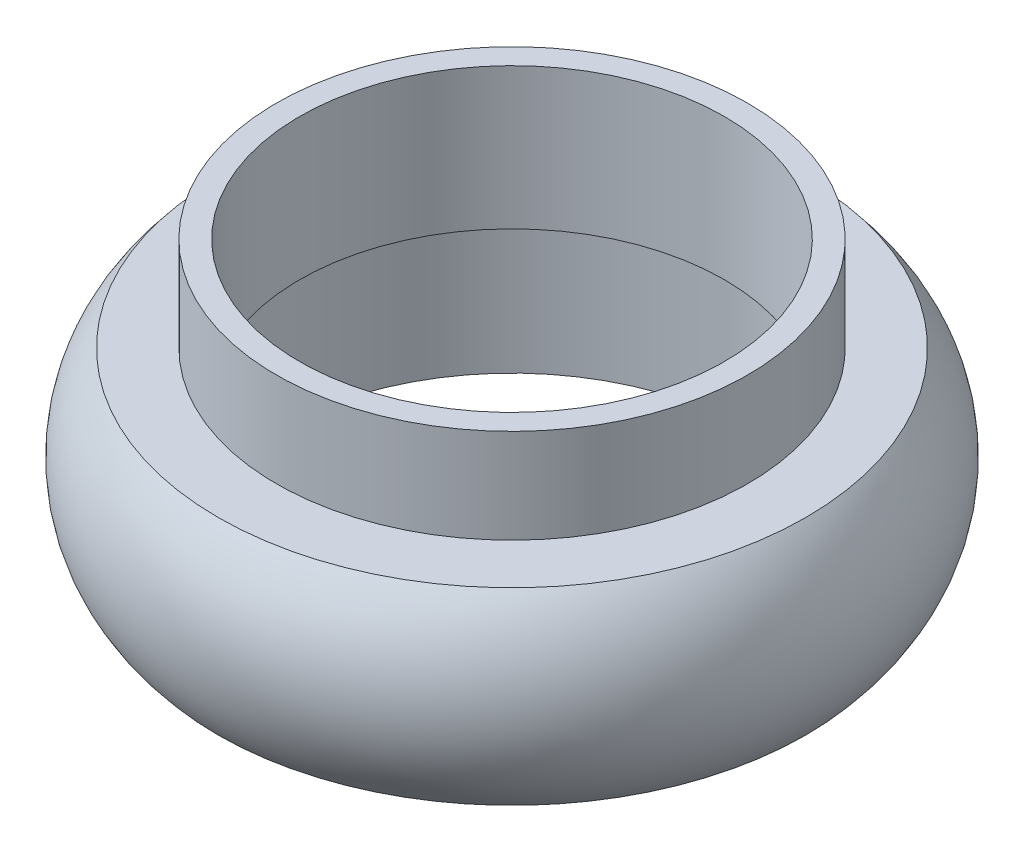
SolidWorks part; units mm, degrees
ref_plane "Front Plane" through (0, 0, 0) normal (0, 0, 1) x (1, 0, 0)
ref_plane "Top Plane" through (0, 0, 0) normal (0, 1, 0) x (1, 0, 0)
ref_plane "Right Plane" through (0, 0, 0) normal (1, 0, 0) x (0, 0, -1)
sketch "Sketch1" plane through (0, 0, 0) normal (0, 0, 1) x (1, 0, 0)
  line L0 (0, 0) -> (0, 35.068) construction
  line L1 (14.3116, 9.525) -> (14.3116, 19.05)
  line L2 (14.3116, 19.05) -> (15.875, 19.05)
  line L3 (15.875, 19.05) -> (15.875, 12.7)
  line L4 (15.875, 12.7) -> (19.7995, 12.7)
  line L5 (15.875, 0) -> (19.7995, 0)
  line L6 (14.3116, 9.525) -> (15.875, 9.525)
  line L7 (15.875, 9.525) -> (15.875, 0)
  arc A0 (19.7995, 0) -> (19.7995, 12.7) centre (12.7, 6.35) ccw
  dimension "D4" = 9.525
  dimension "D1" = 14.3116
  dimension "D2" = 15.875
  dimension "D3" = 12.7
  dimension "D5" = 12.7
  dimension "D6" = 19.05
  dimension "D7" = 15.875
  dimension "D8" = 9.525
revolve "Revolve1" add sketch "Sketch1" angle 360 about L0
